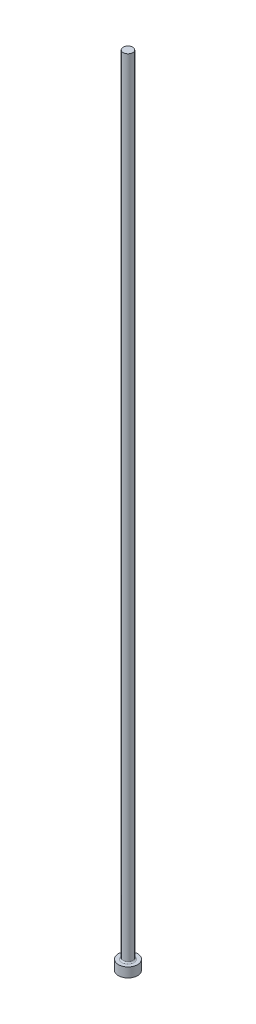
SolidWorks part; units mm, degrees
ref_plane "Plano frontal" through (0, 0, 0) normal (0, 0, 1) x (1, 0, 0)
ref_plane "Plano superior" through (0, 0, 0) normal (0, 1, 0) x (1, 0, 0)
ref_plane "Plano direito" through (0, 0, 0) normal (1, 0, 0) x (0, 0, -1)
sketch "Esboço1" plane through (0, 0, 0) normal (0, 0, 1) x (1, 0, 0)
  line L0 (0, 0) -> (1.5, 0)
  line L1 (1.5, 0) -> (1.5, 1.5)
  line L2 (1.5, 1.5) -> (0.95, 1.5)
  line L3 (0.75, 1.7) -> (0.75, 125)
  line L4 (0.75, 125) -> (0, 125)
  line L5 (0, 125) -> (0, 0) construction
  line L6 (0, 0) -> (0, 125)
  arc A0 (0.95, 1.5) -> (0.75, 1.7) centre (0.95, 1.7) cw
  dimension "D3" = 0.2
  dimension "D1" = 3
  dimension "D2" = 1.5
  dimension "D4" = 1.5
  dimension "D5" = 125
revolve "Revolução1" add sketch "Esboço1" angle 360 about L5
sketch "Esboço2"
  dimension "D1" = 0.1125
  dimension "D2" = 0.2625
  dimension "D3" = 0.1687
  dimension "D4" = 0.8063
wrap "Envolver1" sketch "Esboço2" wrap type deboss source sketch "Esboço2" thickness 0.1 parameters "D1"=0.1
